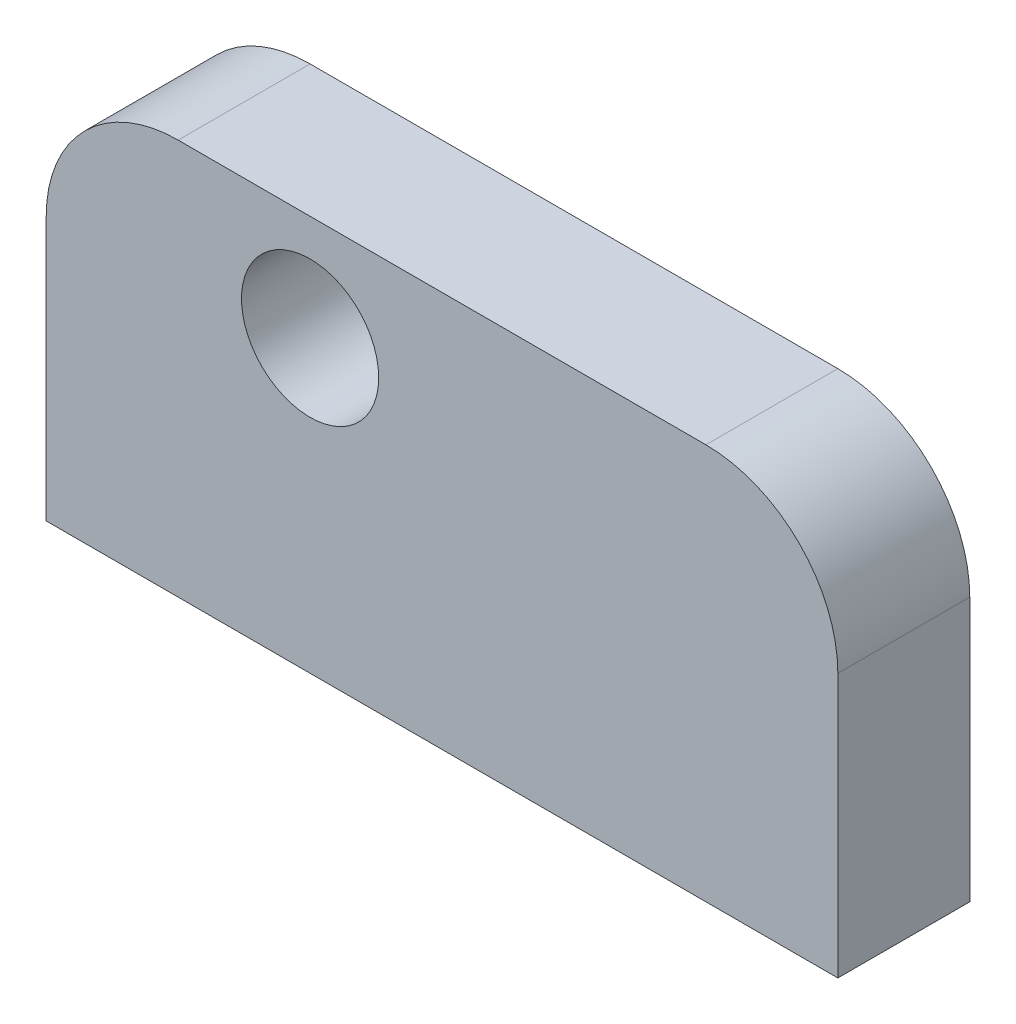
SolidWorks part; units mm, degrees
ref_plane "Front Plane" through (0, 0, 0) normal (0, 0, 1) x (1, 0, 0)
ref_plane "Top Plane" through (0, 0, 0) normal (0, 1, 0) x (1, 0, 0)
ref_plane "Right Plane" through (0, 0, 0) normal (1, 0, 0) x (0, 0, -1)
sketch "Sketch1" plane through (0, 0, 0) normal (0, 0, 1) x (1, 0, 0)
  line L0 (55.118, -57.023) -> (55.118, -37.973)
  line L1 (55.118, -37.973) -> (17.018, -37.973)
  line L2 (17.018, -37.973) -> (17.018, -57.023)
  line L3 (17.018, -57.023) -> (55.118, -57.023)
  circle A0 centre (29.718, -43.053) radius 3.302
  dimension "D1" = 6.604
  dimension "D2" = 5.08
  dimension "D3" = 12.7
  dimension "D4" = 38.1
  dimension "D5" = 19.05
extrude "Boss-Extrude1" add sketch "Sketch1" along normal blind 6.35
fillet "Fillet1" radius 6.35 2 edges at (55.118, -37.973, 3.175) (17.018, -37.973, 3.175)
